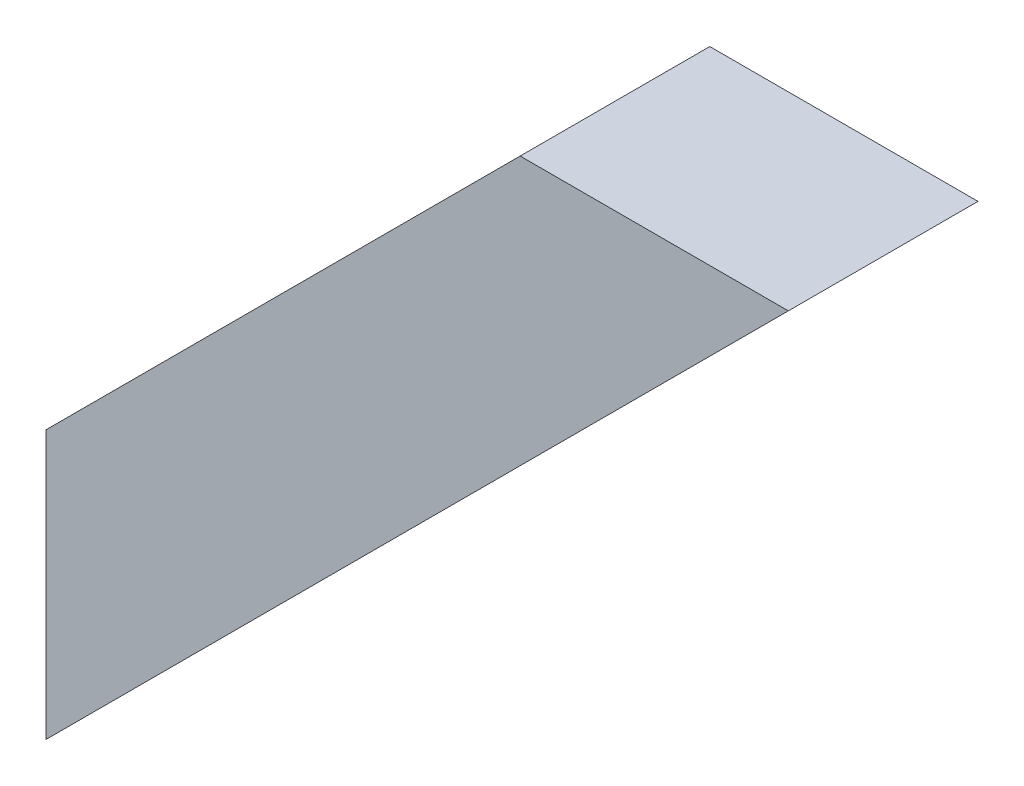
SolidWorks part; units mm, degrees
ref_plane "Front" through (0, 0, 0) normal (0, 0, 1) x (1, 0, 0)
ref_plane "Top" through (0, 0, 0) normal (0, 1, 0) x (1, 0, 0)
ref_plane "Right" through (0, 0, 0) normal (1, 0, 0) x (0, 0, -1)
sketch "Esquisse1" plane through (0, 0, 0) normal (0, 0, 1) x (1, 0, 0)
  line L0 (0, 0) -> (128.9474, 0) construction
  line L1 (0, 0) -> (0, -93.5855) construction
  line L2 (0, -300) -> (300, 0)
  line L3 (300, 0) -> (384.8528, -84.8528) construction
  line L4 (0, -300) -> (84.8528, -384.8528) construction
  line L5 (300, 0) -> (711.5592, 0) construction
  line L6 (0, -300) -> (0, -639.7631) construction
  line L9 (84.8528, -384.8528) -> (0, -469.7056) construction
  line L10 (0, -469.7056) -> (0, -639.7631) construction
  line L11 (0, -300) -> (0, -469.7056)
  line L12 (0, -469.7056) -> (84.8528, -384.8528)
  line L13 (84.8528, -384.8528) -> (469.7056, 0)
  line L14 (300, 0) -> (469.7056, 0)
  point P3 (300, 0)
  point P4 (0, -300)
  dimension "D1" = 300
  dimension "D2" = 300
  dimension "D3" = 120
  dimension "D4" = 120
extrude "Boss.-Extru.1" add sketch "Esquisse1" along normal blind 120
